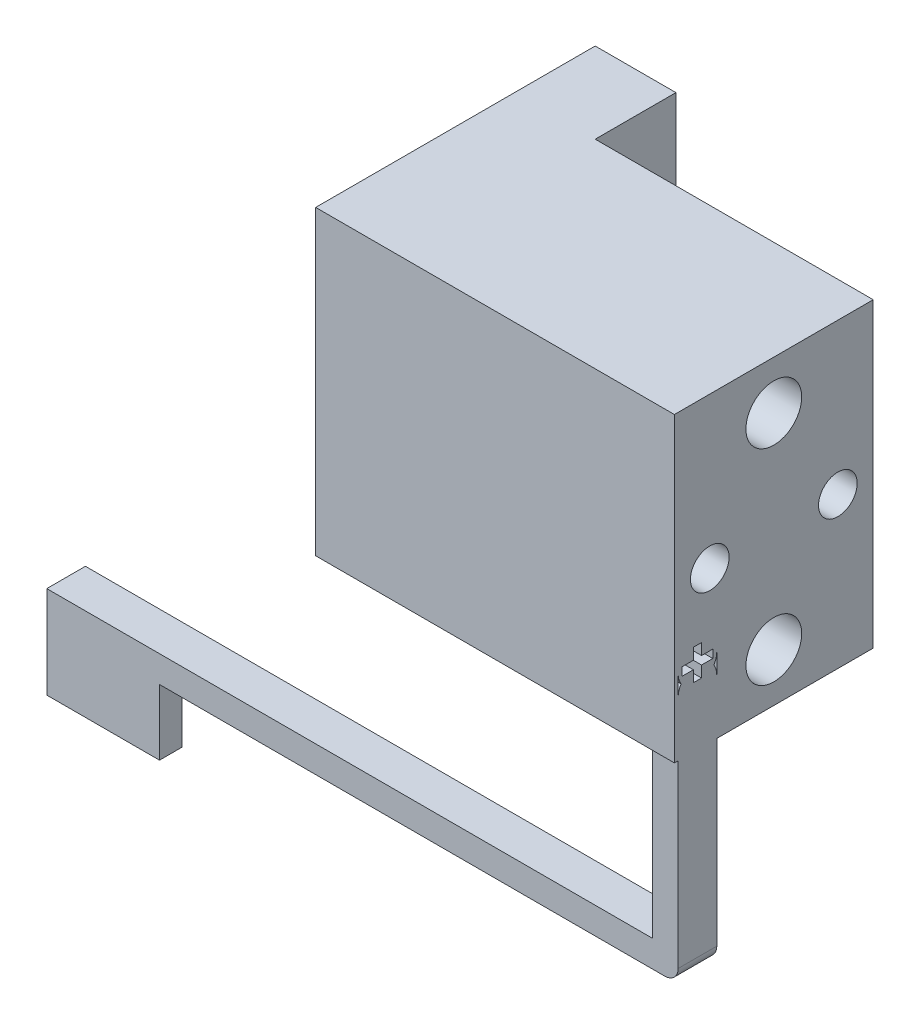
SolidWorks part; units mm, degrees
ref_plane "Plane1" through (0, 0, 0) normal (0, 0, 1) x (1, 0, 0)
ref_plane "Plane2" through (0, 0, 0) normal (0, 1, 0) x (1, 0, 0)
ref_plane "Plane3" through (0, 0, 0) normal (1, 0, 0) x (0, 0, -1)
imported_body "Imported1"
sketch "Sketch1" plane through (51.579, 0, 0) normal (-1, 0, 0) x (0, 0, 1)
  line L0 (31.158, -1.0516) -> (28.7627, -1.0516)
  line L1 (28.7627, -1.0516) -> (28.7627, 9.2685)
  line L2 (28.7627, 9.2685) -> (31.158, 9.2685)
  line L3 (31.158, 9.2685) -> (31.158, -1.0516)
  line L4 (31.158, 9.2685) -> (31.3891, 9.2685) construction
  line L5 (28.7627, -1.0516) -> (31.158, -1.0516) construction
  line L6 (28.7627, -1.0516) -> (28.7627, 9.2685) construction
  line L7 (31.158, -1.8771) -> (31.158, 9.2685) construction
extrude "Cut-Extrude1" cut sketch "Sketch1" against normal blind 0.0635
